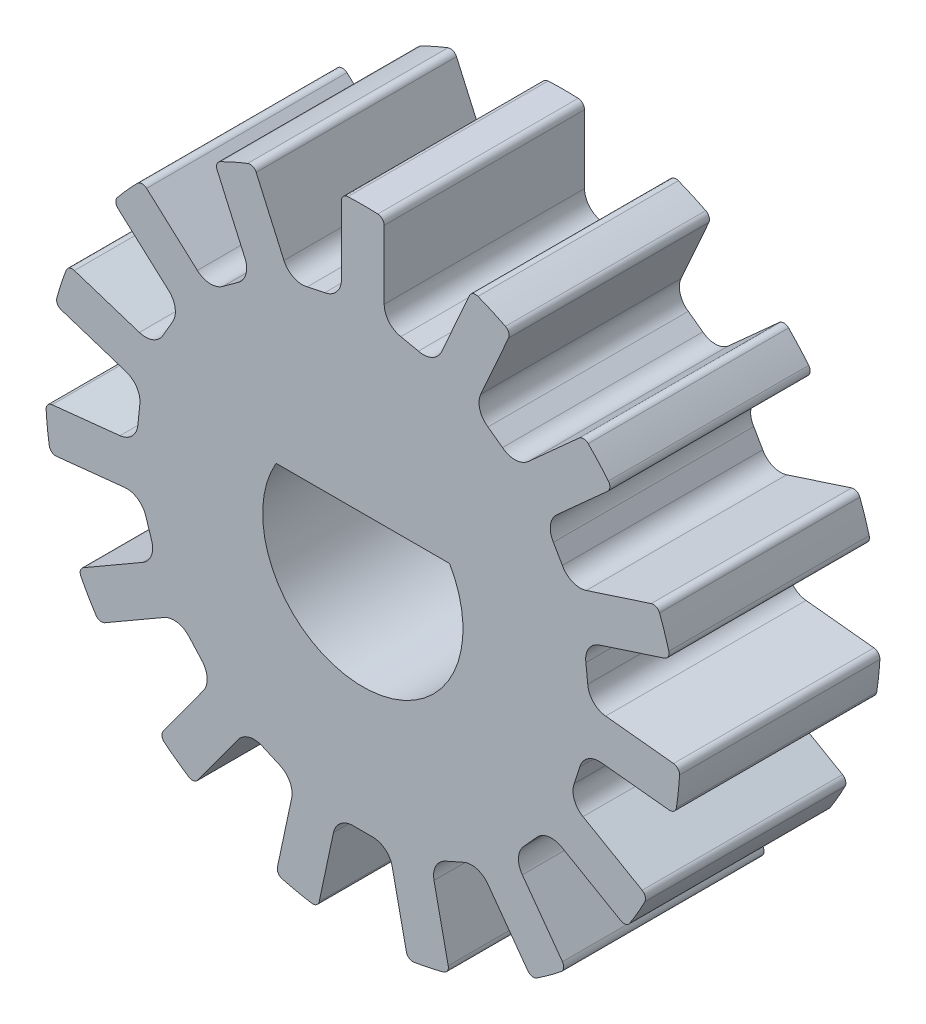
SolidWorks part; units mm, degrees
ref_plane "Plan de face" through (0, 0, 0) normal (0, 0, 1) x (1, 0, 0)
ref_plane "Plan de dessus" through (0, 0, 0) normal (0, 1, 0) x (1, 0, 0)
ref_plane "Plan de droite" through (0, 0, 0) normal (1, 0, 0) x (0, 0, -1)
sketch "Esquisse1" plane through (0, 0, 0) normal (0, 0, 1) x (1, 0, 0)
  line L0 (0, 0.75) -> (0, 5.2039) construction
  line L3 (-1.299, 0.75) -> (1.299, 0.75)
  circle A0 centre (0, 0) radius 4.75
  arc A1 (-1.299, 0.75) -> (1.299, 0.75) centre (0, 0) ccw
  dimension "D1" = 3
  dimension "D2" = 9.5
  dimension "D5" = 0.75
extrude "Extrusion1" add sketch "Esquisse1" along normal blind 3
sketch "Esquisse2" plane through (0, 0, 3) normal (0, 0, 1) x (1, 0, 0)
  line L0 (-0.8329, 3.2706) -> (-0.5694, 3.3266)
  line L1 (0.5694, 3.3266) -> (0.8329, 3.2706)
  line L2 (1.6353, 4.4596) -> (1.181, 3.4393)
  line L3 (-0.32, 4.7392) -> (-0.32, 3.6223)
  line L4 (0.32, 4.7392) -> (0.32, 3.6223)
  line L5 (2.2199, 4.1993) -> (1.7657, 3.179)
  line L6 (1.8732, 2.8074) -> (2.0912, 2.6491)
  line L7 (3.3078, 3.409) -> (2.4778, 2.6616)
  line L8 (3.736, 2.9333) -> (2.906, 2.186)
  line L9 (2.8532, 1.8028) -> (2.9879, 1.5695)
  line L10 (4.4084, 1.7688) -> (3.3461, 1.4237)
  line L11 (4.6061, 1.1602) -> (3.5439, 0.815)
  line L12 (3.3398, 0.4865) -> (3.3679, 0.2185)
  line L13 (4.7467, -0.1771) -> (3.6359, -0.0604)
  line L14 (4.6798, -0.8136) -> (3.569, -0.6969)
  line L15 (3.2489, -0.914) -> (3.1656, -1.1702)
  line L16 (4.2643, -2.0925) -> (3.297, -1.534)
  line L17 (3.9443, -2.6467) -> (2.977, -2.0883)
  line L18 (2.5962, -2.1564) -> (2.416, -2.3566)
  line L19 (3.0445, -3.646) -> (2.388, -2.7424)
  line L20 (2.5268, -4.0222) -> (1.8703, -3.1186)
  line L21 (1.4947, -3.026) -> (1.2486, -3.1355)
  line L22 (1.2983, -4.5691) -> (1.0661, -3.4766)
  line L23 (0.6723, -4.7022) -> (0.4401, -3.6097)
  line L24 (0.1347, -3.3723) -> (-0.1347, -3.3723)
  line L25 (-0.6723, -4.7022) -> (-0.4401, -3.6097)
  line L26 (-1.2983, -4.5691) -> (-1.0661, -3.4766)
  line L27 (-1.2486, -3.1355) -> (-1.4947, -3.026)
  line L28 (-2.5268, -4.0222) -> (-1.8703, -3.1186)
  line L29 (-3.0445, -3.646) -> (-2.388, -2.7424)
  line L30 (-2.416, -2.3566) -> (-2.5962, -2.1564)
  line L31 (-3.9443, -2.6467) -> (-2.977, -2.0883)
  line L32 (-4.2643, -2.0925) -> (-3.297, -1.534)
  line L33 (-3.1656, -1.1702) -> (-3.2489, -0.914)
  line L34 (-4.6798, -0.8136) -> (-3.569, -0.6969)
  line L35 (-4.7467, -0.1771) -> (-3.6359, -0.0604)
  line L36 (-3.3679, 0.2185) -> (-3.3398, 0.4865)
  line L37 (-4.6061, 1.1602) -> (-3.5439, 0.815)
  line L38 (-4.4084, 1.7688) -> (-3.3461, 1.4237)
  line L39 (-2.9879, 1.5695) -> (-2.8532, 1.8028)
  line L40 (-3.736, 2.9333) -> (-2.906, 2.186)
  line L41 (-3.3078, 3.409) -> (-2.4778, 2.6616)
  line L42 (-2.0912, 2.6491) -> (-1.8732, 2.8074)
  line L43 (-2.2199, 4.1993) -> (-1.7657, 3.179)
  line L44 (-1.6353, 4.4596) -> (-1.181, 3.4393)
  line L195 (-0.5694, 3.3266) -> (-0.9304, 3.2442)
  line L196 (0.8329, 3.2706) -> (0.4696, 3.3422)
  line L197 (-1.8732, 2.8074) -> (-2.1695, 2.5853)
  line L198 (-2.8532, 1.8028) -> (-3.0335, 1.4794)
  line L199 (-3.3398, 0.4865) -> (-3.3729, 0.1177)
  line L200 (-3.2489, -0.914) -> (-3.1292, -1.2644)
  line L201 (-2.5962, -2.1564) -> (-2.3444, -2.4278)
  line L202 (2.0912, 2.6491) -> (1.7884, 2.8622)
  line L203 (2.9879, 1.5695) -> (2.7979, 1.8874)
  line L204 (3.3679, 0.2185) -> (3.3237, 0.5862)
  line L205 (3.1656, -1.1702) -> (3.2748, -0.8164)
  line L206 (2.416, -2.3566) -> (2.6596, -2.0778)
  line L207 (1.2486, -3.1355) -> (1.5846, -2.9799)
  line L208 (-0.1347, -3.3723) -> (0.2355, -3.3668)
  line L209 (-1.4947, -3.026) -> (-1.1542, -3.1715)
  circle A0 centre (0, 0) radius 4.75 construction
  arc A2 (0.32, 4.7392) -> (-0.32, 4.7392) centre (0, 0) ccw
  arc A3 (-0.32, 3.6223) -> (-0.5694, 3.3266) centre (-0.62, 3.6223) cw
  arc A4 (0.32, 3.6223) -> (0.5694, 3.3266) centre (0.62, 3.6223) ccw
  arc A5 (2.2199, 4.1993) -> (1.6353, 4.4596) centre (0, 0) ccw
  arc A6 (1.181, 3.4393) -> (0.8329, 3.2706) centre (0.9069, 3.5613) cw
  arc A7 (1.7657, 3.179) -> (1.8732, 2.8074) centre (2.0397, 3.057) ccw
  arc A8 (3.736, 2.9333) -> (3.3078, 3.409) centre (0, 0) ccw
  arc A9 (2.4778, 2.6616) -> (2.0912, 2.6491) centre (2.277, 2.8846) cw
  arc A10 (2.906, 2.186) -> (2.8532, 1.8028) centre (3.1068, 1.9631) ccw
  arc A11 (4.6061, 1.1602) -> (4.4084, 1.7688) centre (0, 0) ccw
  arc A12 (3.3461, 1.4237) -> (2.9879, 1.5695) centre (3.2534, 1.709) cw
  arc A13 (3.5439, 0.815) -> (3.3398, 0.4865) centre (3.6366, 0.5297) ccw
  arc A14 (4.6798, -0.8136) -> (4.7467, -0.1771) centre (0, 0) ccw
  arc A15 (3.6359, -0.0604) -> (3.3679, 0.2185) centre (3.6673, 0.238) cw
  arc A16 (3.569, -0.6969) -> (3.2489, -0.914) centre (3.5377, -0.9952) ccw
  arc A17 (3.9443, -2.6467) -> (4.2643, -2.0925) centre (0, 0) ccw
  arc A18 (3.297, -1.534) -> (3.1656, -1.1702) centre (3.447, -1.2742) cw
  arc A19 (2.977, -2.0883) -> (2.5962, -2.1564) centre (2.827, -2.3481) ccw
  arc A20 (2.5268, -4.0222) -> (3.0445, -3.646) centre (0, 0) ccw
  arc A21 (2.388, -2.7424) -> (2.416, -2.3566) centre (2.6307, -2.5661) cw
  arc A22 (1.8703, -3.1186) -> (1.4947, -3.026) centre (1.6276, -3.2949) ccw
  arc A23 (0.6723, -4.7022) -> (1.2983, -4.5691) centre (0, 0) ccw
  arc A24 (1.0661, -3.4766) -> (1.2486, -3.1355) centre (1.3596, -3.4143) cw
  arc A25 (0.4401, -3.6097) -> (0.1347, -3.3723) centre (0.1467, -3.6721) ccw
  arc A26 (-1.2983, -4.5691) -> (-0.6723, -4.7022) centre (0, 0) ccw
  arc A27 (-0.4401, -3.6097) -> (-0.1347, -3.3723) centre (-0.1467, -3.6721) cw
  arc A28 (-1.0661, -3.4766) -> (-1.2486, -3.1355) centre (-1.3596, -3.4143) ccw
  arc A29 (-3.0445, -3.646) -> (-2.5268, -4.0222) centre (0, 0) ccw
  arc A30 (-1.8703, -3.1186) -> (-1.4947, -3.026) centre (-1.6276, -3.2949) cw
  arc A31 (-2.388, -2.7424) -> (-2.416, -2.3566) centre (-2.6307, -2.5661) ccw
  arc A32 (-4.2643, -2.0925) -> (-3.9443, -2.6467) centre (0, 0) ccw
  arc A33 (-2.977, -2.0883) -> (-2.5962, -2.1564) centre (-2.827, -2.3481) cw
  arc A34 (-3.297, -1.534) -> (-3.1656, -1.1702) centre (-3.447, -1.2742) ccw
  arc A35 (-4.7467, -0.1771) -> (-4.6798, -0.8136) centre (0, 0) ccw
  arc A36 (-3.569, -0.6969) -> (-3.2489, -0.914) centre (-3.5377, -0.9952) cw
  arc A37 (-3.6359, -0.0604) -> (-3.3679, 0.2185) centre (-3.6673, 0.238) ccw
  arc A38 (-4.4084, 1.7688) -> (-4.6061, 1.1602) centre (0, 0) ccw
  arc A39 (-3.5439, 0.815) -> (-3.3398, 0.4865) centre (-3.6366, 0.5297) cw
  arc A40 (-3.3461, 1.4237) -> (-2.9879, 1.5695) centre (-3.2534, 1.709) ccw
  arc A41 (-3.3078, 3.409) -> (-3.736, 2.9333) centre (0, 0) ccw
  arc A42 (-2.906, 2.186) -> (-2.8532, 1.8028) centre (-3.1068, 1.9631) cw
  arc A43 (-2.4778, 2.6616) -> (-2.0912, 2.6491) centre (-2.277, 2.8846) ccw
  arc A44 (-1.6353, 4.4596) -> (-2.2199, 4.1993) centre (0, 0) ccw
  arc A45 (-1.7657, 3.179) -> (-1.8732, 2.8074) centre (-2.0397, 3.057) cw
  arc A46 (-1.181, 3.4393) -> (-0.8329, 3.2706) centre (-0.9069, 3.5613) ccw
extrude "Enlèv. mat.-Extru.1" cut sketch "Esquisse2" against normal through all flip side to cut
fillet "Congé2" radius 0.1 30 edges at (-3.0445, -3.646, 1.5) (1.2983, -4.5691, 1.5) (3.0445, -3.646, 1.5) (4.2643, -2.0925, 1.5) (4.7467, -0.1771, 1.5) (4.6061, 1.1602, 1.5) (4.4084, 1.7688, 1.5) (3.736, 2.9333, 1.5) (3.3078, 3.409, 1.5) (2.2199, 4.1993, 1.5) (1.6353, 4.4596, 1.5) (0.32, 4.7392, 1.5) (-0.32, 4.7392, 1.5) (-1.6353, 4.4596, 1.5) (-2.2199, 4.1993, 1.5) (-4.2643, -2.0925, 1.5) (-4.7467, -0.1771, 1.5) (-4.4084, 1.7688, 1.5) (-3.736, 2.9333, 1.5) (-3.3078, 3.409, 1.5) (0.6723, -4.7022, 1.5) (-0.6723, -4.7022, 1.5) (-1.2983, -4.5691, 1.5) (-2.5268, -4.0222, 1.5) (-3.9443, -2.6467, 1.5) (-4.6798, -0.8136, 1.5) (-4.6061, 1.1602, 1.5) (4.6798, -0.8136, 1.5) (3.9443, -2.6467, 1.5) (2.5268, -4.0222, 1.5)
